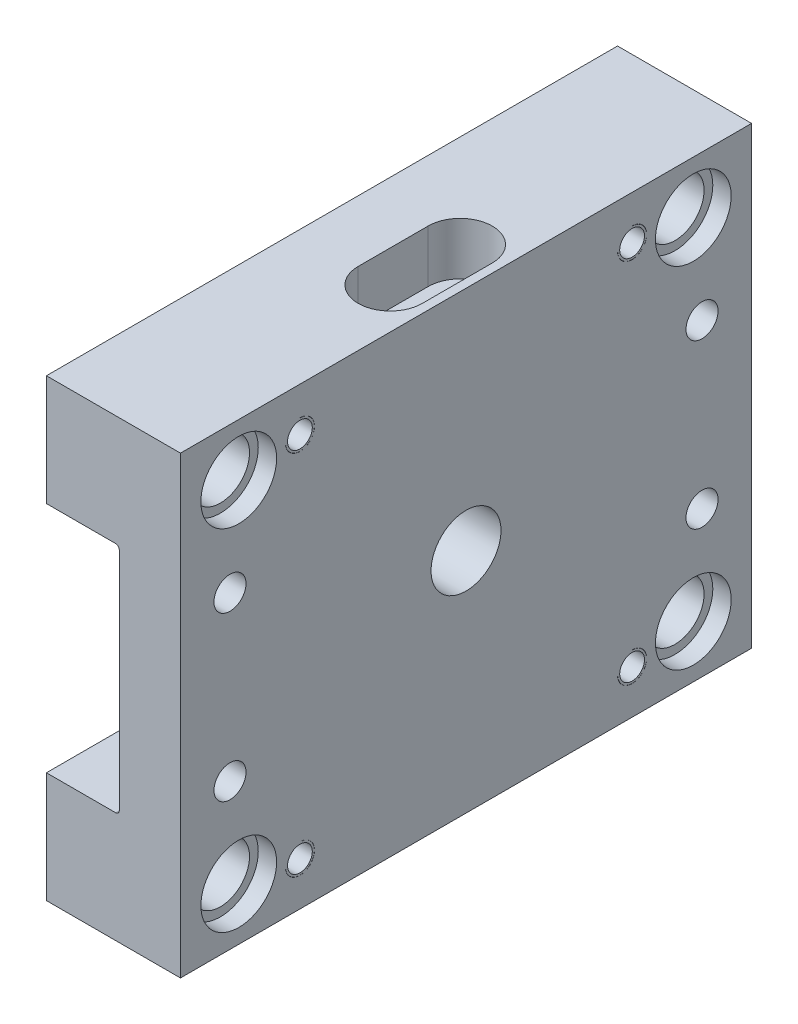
SolidWorks part; units mm, degrees
ref_plane "Plan de face" through (0, 0, 0) normal (0, 0, 1) x (1, 0, 0)
ref_plane "Plan de dessus" through (0, 0, 0) normal (0, 1, 0) x (1, 0, 0)
ref_plane "Plan de droite" through (0, 0, 0) normal (1, 0, 0) x (0, 0, -1)
ref_plane "Plan1" through (0, 0, 0) normal (-1, 0, 0) x (0, -1, 0)
sketch "Esquisse1" plane through (0, 0, 0) normal (-1, 0, 0) x (0, -1, 0)
  line L0 (78, 98) -> (-78, 98)
  line L1 (-78, 98) -> (-78, -98)
  line L2 (-78, -98) -> (78, -98)
  line L3 (78, -98) -> (78, 98)
extrude "Boss.-Extru.1" add sketch "Esquisse1" against normal blind 46
sketch "Esquisse2" plane through (0, 0, 98) normal (0, 0, 1) x (1, 0, 0)
  line L0 (0, 40) -> (0, -40)
  line L1 (0, -40) -> (25, -40)
  line L2 (25, -40) -> (25, 40)
  line L3 (25, 40) -> (0, 40)
extrude "Enlèv. mat.-Extru.1" cut sketch "Esquisse2" against normal through all
sketch "Esquisse3" plane through (25, 0, 0) normal (-1, 0, 0) x (0, 0, 1)
  line L0 (-64.95, 15.5) -> (-65, 15.5)
  line L1 (-62, 18.5) -> (-62, 18.45)
  arc A0 (-62, 18.45) -> (-64.95, 15.5) centre (-62, 15.5) cw
  arc A1 (-65, 15.5) -> (-62, 18.5) centre (-62, 15.5) ccw
extrude "Enlèv. mat.-Extru.2" cut sketch "Esquisse3" against normal blind 14
sketch "Esquisse4" plane through (25, 0, 0) normal (-1, 0, 0) x (0, 0, 1)
  line L0 (59.05, 15.5) -> (59, 15.5)
  line L1 (62, 18.5) -> (62, 18.45)
  arc A0 (62, 18.45) -> (59.05, 15.5) centre (62, 15.5) cw
  arc A1 (59, 15.5) -> (62, 18.5) centre (62, 15.5) ccw
extrude "Enlèv. mat.-Extru.3" cut sketch "Esquisse4" against normal blind 14
sketch "Esquisse5" plane through (25, 0, 0) normal (-1, 0, 0) x (0, 0, 1)
  line L0 (59.05, -15.5) -> (59, -15.5)
  line L1 (62, -12.5) -> (62, -12.55)
  arc A0 (62, -12.55) -> (59.05, -15.5) centre (62, -15.5) cw
  arc A1 (59, -15.5) -> (62, -12.5) centre (62, -15.5) ccw
extrude "Enlèv. mat.-Extru.4" cut sketch "Esquisse5" against normal blind 14
sketch "Esquisse6" plane through (25, 0, 0) normal (-1, 0, 0) x (0, 0, 1)
  line L0 (-64.95, -15.5) -> (-65, -15.5)
  line L1 (-62, -12.5) -> (-62, -12.55)
  arc A0 (-62, -12.55) -> (-64.95, -15.5) centre (-62, -15.5) cw
  arc A1 (-65, -15.5) -> (-62, -12.5) centre (-62, -15.5) ccw
extrude "Enlèv. mat.-Extru.5" cut sketch "Esquisse6" against normal blind 14
sketch "Esquisse7" plane through (25, 0, 0) normal (-1, 0, 0) x (0, 0, 1)
  line L0 (-86, 34) -> (-86, -34)
  line L1 (-76, -34) -> (-76, 34)
  arc A0 (-86, -34) -> (-76, -34) centre (-81, -34) ccw
  arc A1 (-76, 34) -> (-86, 34) centre (-81, 34) ccw
extrude "Enlèv. mat.-Extru.6" cut sketch "Esquisse7" against normal blind 4.5
sketch "Esquisse8" plane through (25, 0, 0) normal (-1, 0, 0) x (0, 0, 1)
  line L0 (76, 34) -> (76, -34)
  line L1 (86, -34) -> (86, 34)
  arc A0 (76, -34) -> (86, -34) centre (81, -34) ccw
  arc A1 (86, 34) -> (76, 34) centre (81, 34) ccw
extrude "Enlèv. mat.-Extru.7" cut sketch "Esquisse8" against normal blind 4.5
sketch "Esquisse9" plane through (46, 0, 0) normal (1, 0, 0) x (0, 0, -1)
  line L0 (52.05, -63) -> (52, -63)
  line L1 (57, -58) -> (57, -58.05)
  arc A0 (57, -58.05) -> (52.05, -63) centre (57, -63) cw
  arc A1 (52, -63) -> (57, -58) centre (57, -63) ccw
extrude "Enlèv. mat.-Extru.8" cut sketch "Esquisse9" against normal blind 15
sketch "Esquisse10" plane through (46, 0, 0) normal (1, 0, 0) x (0, 0, -1)
  line L0 (-61.95, -63) -> (-62, -63)
  line L1 (-57, -58) -> (-57, -58.05)
  arc A0 (-57, -58.05) -> (-61.95, -63) centre (-57, -63) cw
  arc A1 (-62, -63) -> (-57, -58) centre (-57, -63) ccw
extrude "Enlèv. mat.-Extru.9" cut sketch "Esquisse10" against normal blind 15
sketch "Esquisse11" plane through (46, 0, 0) normal (1, 0, 0) x (0, 0, -1)
  line L0 (-61.95, 63) -> (-62, 63)
  line L1 (-57, 68) -> (-57, 67.95)
  arc A0 (-57, 67.95) -> (-61.95, 63) centre (-57, 63) cw
  arc A1 (-62, 63) -> (-57, 68) centre (-57, 63) ccw
extrude "Enlèv. mat.-Extru.10" cut sketch "Esquisse11" against normal blind 15
sketch "Esquisse12" plane through (46, 0, 0) normal (1, 0, 0) x (0, 0, -1)
  line L0 (52.05, 63) -> (52, 63)
  line L1 (57, 68) -> (57, 67.95)
  arc A0 (57, 67.95) -> (52.05, 63) centre (57, 63) cw
  arc A1 (52, 63) -> (57, 68) centre (57, 63) ccw
extrude "Enlèv. mat.-Extru.11" cut sketch "Esquisse12" against normal blind 15
sketch "Esquisse13" plane through (0, 78, 0) normal (0, 1, 0) x (-1, 0, 0)
  line L0 (-43, 12) -> (-43, -12)
  line L1 (-21, -12) -> (-21, 12)
  arc A0 (-21, 12) -> (-43, 12) centre (-32, 12) ccw
  arc A1 (-43, -12) -> (-21, -12) centre (-32, -12) ccw
extrude "Enlèv. mat.-Extru.12" cut sketch "Esquisse13" against normal blind 18
sketch "Esquisse14" plane through (0, 60, 0) normal (0, 1, 0) x (-1, 0, 0)
  line L0 (-32, -7.05) -> (-32, -7)
  line L1 (-27, -12) -> (-27.05, -12)
  arc A0 (-27.05, -12) -> (-32, -7.05) centre (-32, -12) cw
  arc A1 (-32, -7) -> (-27, -12) centre (-32, -12) ccw
extrude "Enlèv. mat.-Extru.13" cut sketch "Esquisse14" against normal blind 9
sketch "Esquisse15" plane through (0, 60, 0) normal (0, 1, 0) x (-1, 0, 0)
  line L0 (-32, 16.95) -> (-32, 17)
  line L1 (-27, 12) -> (-27.05, 12)
  arc A0 (-27.05, 12) -> (-32, 16.95) centre (-32, 12) cw
  arc A1 (-32, 17) -> (-27, 12) centre (-32, 12) ccw
extrude "Enlèv. mat.-Extru.14" cut sketch "Esquisse15" against normal blind 9
hole_wizard "Dégagement M101" positions "Esquisse17" profile "Esquisse16" hole size "M10" standard "Ansi Metric"
sketch "Esquisse17" plane through (25, 0, 0) normal (-1, 0, 0) x (0, 0, 1)
  point P0 (12, 32.5)
sketch "Esquisse16" plane through (25, 32.5, 12) normal (0, 1, 0) x (0, 0, 1)
  line L0 (0, 0) -> (0, 1.2)
  line L1 (0, 1.2) -> (5.45, 1.2)
  line L2 (5.45, 1.2) -> (5.45, 0)
  line L5 (5.45, 0) -> (0, 0)
  line L10 (0, 1.2) -> (-5.45, 1.2) construction
  line L11 (0, -6.35) -> (0, 107.95) construction
  dimension "Diamètre du perçage" = 10.9
  dimension "Profondeur du perçage" = 1.2
  dimension "Angle de pointe" = 180
hole_wizard "Dégagement M102" positions "Esquisse19" profile "Esquisse18" hole size "M10" standard "Ansi Metric"
sketch "Esquisse19" plane through (25, 0, 0) normal (-1, 0, 0) x (0, 0, 1)
  point P0 (-12, 32.5)
sketch "Esquisse18" plane through (25, 32.5, -12) normal (0, 1, 0) x (0, 0, 1)
  line L0 (0, 0) -> (0, 1.2)
  line L1 (0, 1.2) -> (5.45, 1.2)
  line L2 (5.45, 1.2) -> (5.45, 0)
  line L5 (5.45, 0) -> (0, 0)
  line L10 (0, 1.2) -> (-5.45, 1.2) construction
  line L11 (0, -6.35) -> (0, 107.95) construction
  dimension "Diamètre du perçage" = 10.9
  dimension "Profondeur du perçage" = 1.2
  dimension "Angle de pointe" = 180
ref_plane "Plan2" through (0, 0, -12) normal (0, 0, -1) x (-1, 0, 0)
sketch "Esquisse20" plane through (0, 0, -12) normal (0, 0, -1) x (-1, 0, 0)
  line L0 (-26.2, 36.05) -> (-26.2, 32.5)
  line L1 (-26.2, 32.5) -> (-25, 32.5)
  line L2 (-25, 32.5) -> (-25, 36.05)
  line L3 (-25, 36.05) -> (-26.2, 36.05)
  line L4 (-26.2, 32.5) -> (-25, 32.5) construction
revolve "Révolution1" add sketch "Esquisse20" angle 360 about L4
hole_wizard "Diamètre du perçage Ø6.0 (6)1" positions "Esquisse23" profile "Esquisse22" hole size "Ø6.0" standard "Ansi Metric"
sketch "Esquisse23" plane through (25, 0, 0) normal (-1, 0, 0) x (0, 0, 1)
  point P0 (-12, 32.5)
  point P1 (12, 32.5)
sketch "Esquisse22" plane through (25, 32.5, -12) normal (0, 1, 0) x (0, 0, 1)
  line L0 (0, 0) -> (0, 13)
  line L1 (0, 13) -> (3, 13)
  line L2 (3, 13) -> (3, 0)
  line L5 (3, 0) -> (0, 0)
  line L10 (0, 13) -> (-3, 13) construction
  line L11 (0, -6.35) -> (0, 107.95) construction
  dimension "Diamètre du perçage" = 6
  dimension "Profondeur du perçage" = 13
  dimension "Angle de pointe" = 180
hole_wizard "Perçage1" positions "Esquisse25" profile "Esquisse24" legacy
sketch "Esquisse25" plane through (0, 60, 0) normal (0, 1, 0) x (1, 0, 0)
  point P0 (32, 12)
  point P1 (32, -12)
sketch "Esquisse24" plane through (32, 60, -12) normal (1, 0, 0) x (0, 0, 1)
  line L0 (0, 0) -> (0, 24.5)
  line L1 (0, 24.5) -> (3, 24.5)
  line L2 (3, 24.5) -> (3, 10.2679)
  line L3 (3, 10.2679) -> (4.5, 9.4018)
  line L4 (4.5, 9.4018) -> (4.5, 0)
  line L5 (4.5, 0) -> (0, 0)
  line L6 (0, -6.13) -> (0, 109.2824) construction
  line L7 (-3, 10.2679) -> (-4.5, 9.4018) construction
  line L8 (0, 24.5) -> (-3, 24.5) construction
  dimension "Diamètre" = 6
  dimension "Profondeur" = 24.5
  dimension "Diamètre contre-pointe" = 9
  dimension "Profondeur contre-pointe" = 9.4018
  dimension "Angle contre-pointe" = 119.999
hole_wizard "Diamètre du perçage Ø8.5 (8.5)1" positions "Esquisse27" profile "Esquisse26" hole size "Ø8.5" standard "Ansi Metric"
sketch "Esquisse27" plane through (46, 0, 0) normal (1, 0, 0) x (0, 0, -1)
  point P0 (57, -63)
  point P1 (-57, -63)
  point P2 (-57, 63)
  point P3 (57, 63)
sketch "Esquisse26" plane through (46, -63, -57) normal (0, 1, 0) x (0, 0, -1)
  line L0 (0, 0) -> (0, 20)
  line L1 (0, 20) -> (4.25, 17.5462)
  line L2 (4.25, 17.5462) -> (4.25, 0)
  line L5 (4.25, 0) -> (0, 0)
  line L10 (0, 20) -> (-4.25, 17.5462) construction
  line L11 (0, -6.35) -> (0, 107.95) construction
  dimension "Diamètre du perçage" = 8.5
  dimension "Profondeur du perçage" = 17.5462
  dimension "Angle de pointe" = 119.999
hole_wizard "Chambrage pour vis à tête hexagonale M61" positions "Esquisse29" profile "Esquisse28" counterbore size "M6" standard "Ansi Metric"
sketch "Esquisse29" plane through (46, 0, 0) normal (1, 0, 0) x (0, 0, -1)
  point P0 (81, -28)
  point P1 (-81, -28)
  point P2 (-81, 28)
  point P3 (81, 28)
sketch "Esquisse28" plane through (46, -28, -81) normal (0, 1, 0) x (0, 0, -1)
  line L0 (0, 0) -> (0, 46)
  line L1 (0, 46) -> (3.3, 46)
  line L3 (3.3, 46) -> (3.3, 8.4)
  line L4 (3.3, 8.4) -> (5.5, 8.4)
  line L5 (5.5, 8.4) -> (5.5, 0)
  line L7 (5.5, 0) -> (0, 0)
  line L11 (0, -6.35) -> (0, 107.95) construction
  dimension "Diamètre du perçage jusqu'au prochain" = 6.6
  dimension "Profondeur du perçage jusqu'au prochain" = 46
  dimension "Diamètre du chambrage" = 11
  dimension "Profondeur du chambrage" = 8.4
hole_wizard "Perçage2" positions "Esquisse31" profile "Esquisse30" legacy
sketch "Esquisse31" plane through (46, 0, 0) normal (1, 0, 0) x (0, 0, -1)
  point P0 (78, -60)
  point P1 (-78, -60)
  point P2 (-78, 60)
  point P3 (78, 60)
sketch "Esquisse30" plane through (46, -60, -78) normal (0, 1, 0) x (0, 0, -1)
  line L0 (0, 0) -> (0, 46)
  line L1 (0, 46) -> (10, 46)
  line L2 (10, 46) -> (10, 6.3)
  line L3 (10, 6.3) -> (13, 6.3)
  line L4 (13, 6.3) -> (13, 0)
  line L5 (13, 0) -> (0, 0)
  line L6 (0, 110) -> (0, -10) construction
  dimension "Diamètre" = 20
  dimension "Profondeur" = 46
  dimension "Diamètre chambrage" = 26
  dimension "Profondeur chambrage" = 6.3
hole_wizard "Diamètre du perçage Ø5.0 (5)1" positions "Esquisse33" profile "Esquisse32" hole size "Ø5.0" standard "Ansi Metric"
sketch "Esquisse33" plane through (25, 0, 0) normal (-1, 0, 0) x (0, 0, 1)
  point P0 (-62, -15.5)
  point P1 (62, -15.5)
  point P2 (62, 15.5)
  point P3 (-62, 15.5)
sketch "Esquisse32" plane through (25, -15.5, -62) normal (0, 1, 0) x (0, 0, 1)
  line L0 (0, 0) -> (0, 17.5)
  line L1 (0, 17.5) -> (2.5, 16.0566)
  line L2 (2.5, 16.0566) -> (2.5, 0)
  line L5 (2.5, 0) -> (0, 0)
  line L10 (0, 17.5) -> (-2.5, 16.0566) construction
  line L11 (0, -6.35) -> (0, 107.95) construction
  dimension "Diamètre du perçage" = 5
  dimension "Profondeur du perçage" = 16.0566
  dimension "Angle de pointe" = 119.999
fillet "Congé1" radius 1.25 2 edges at (25, 40, 0) (25, -40, 0)
sketch "Esquisse34" plane through (46, 0, 0) normal (1, 0, 0) x (0, 0, -1)
  circle A0 centre (0, 0) radius 12
extrude "Enlèv. mat.-Extru.15" cut sketch "Esquisse34" against normal through all
